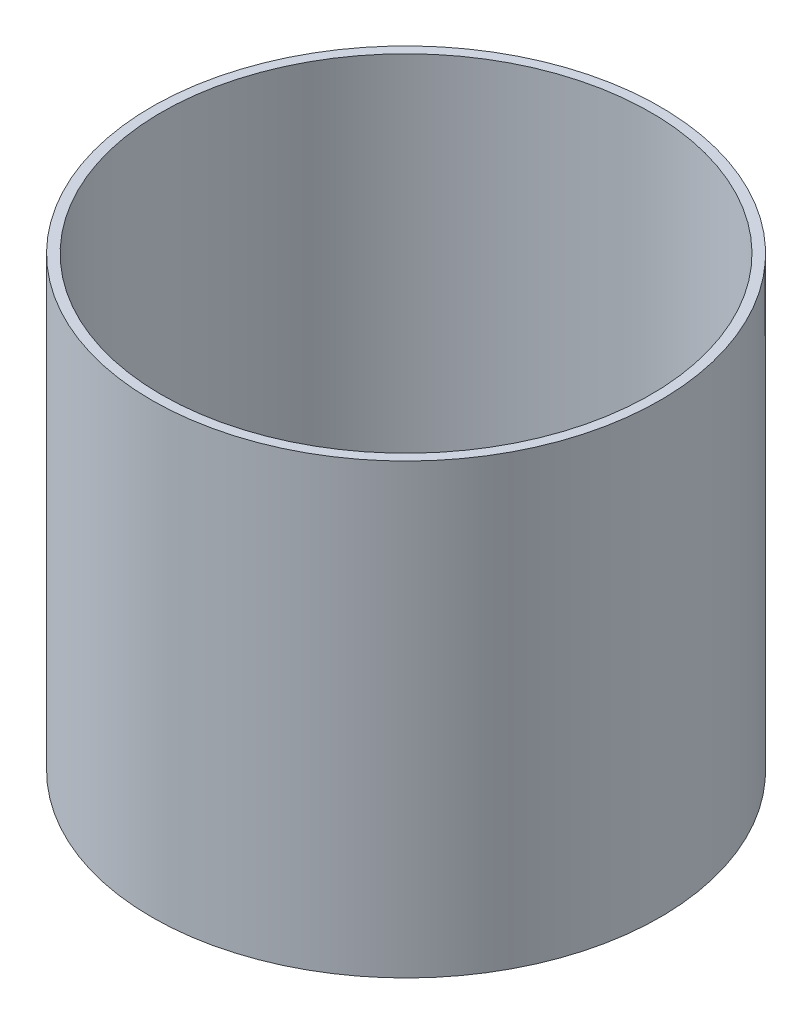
SolidWorks part; units mm, degrees
ref_plane "Front Plane" through (0, 0, 0) normal (0, 0, 1) x (1, 0, 0)
ref_plane "Top Plane" through (0, 0, 0) normal (0, 1, 0) x (1, 0, 0)
ref_plane "Right Plane" through (0, 0, 0) normal (1, 0, 0) x (0, 0, -1)
sketch "Sketch1" plane through (0, 0, 0) normal (0, 1, 0) x (1, 0, 0)
  circle A0 centre (0, 0) radius 39.75
  dimension "D1" = 79.5
extrude "Boss-Extrude1" add sketch "Sketch1" along normal blind 70
shell "Shell1" thickness 1.5
